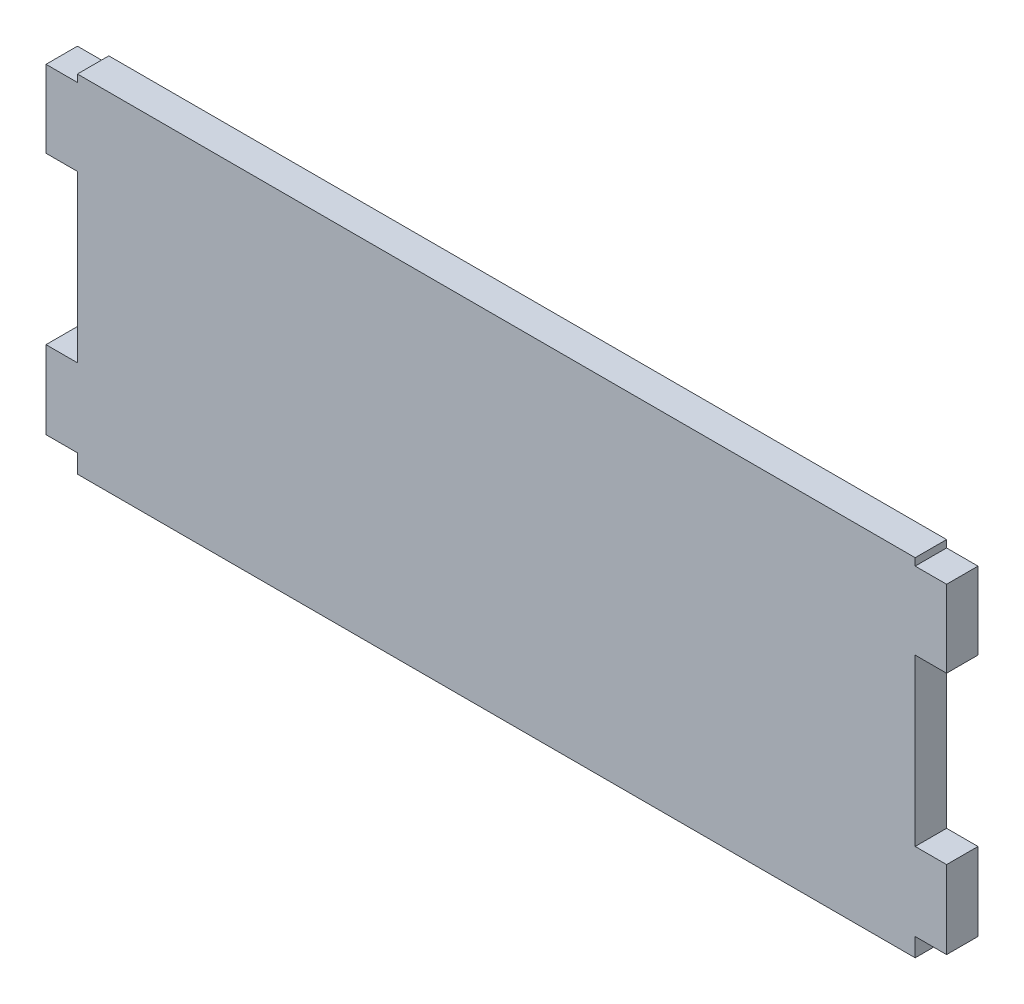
SolidWorks part; units mm, degrees
ref_plane "Plan de face" through (0, 0, 0) normal (0, 0, 1) x (1, 0, 0)
ref_plane "Plan de dessus" through (0, 0, 0) normal (0, 1, 0) x (1, 0, 0)
ref_plane "Plan de droite" through (0, 0, 0) normal (1, 0, 0) x (0, 0, -1)
sketch "Esquisse1" plane through (0, 0, 0) normal (0, 0, 1) x (1, 0, 0)
  line L1 (0, -40.2774) -> (0, 4.4185) construction
  line L2 (0, -4.5914) -> (80, -4.5914)
  line L3 (0, -4.5914) -> (0, -37.6852)
  line L4 (0, -37.6852) -> (80, -37.6852)
  line L5 (80, -4.5914) -> (80, -37.6852)
extrude "Boss.-Extru.1" add sketch "Esquisse1" along normal blind 3
sketch "Esquisse2" plane through (0, 0, 3) normal (0, 0, 1) x (1, 0, 0)
  line L0 (0, -4.5914) -> (0, -37.6852) construction
  line L1 (0, -5.2886) -> (-3, -5.2886)
  line L2 (0, -5.2886) -> (0, -12.648)
  line L3 (0, -12.648) -> (-3, -12.648)
  line L4 (-3, -5.2886) -> (-3, -12.648)
  line L5 (-3, -5.2886) -> (0, -5.2886) construction
  line L6 (-3, -28.4736) -> (0, -28.4736) construction
  line L7 (-3, -20.6165) -> (-3, -67.7761) construction
  line L8 (0, -28.4736) -> (-3, -28.4736)
  line L9 (0, -28.4736) -> (0, -35.92)
  line L10 (0, -35.92) -> (-3, -35.92)
  line L11 (-3, -28.4736) -> (-3, -35.92)
  line L12 (-3, -35.92) -> (0, -35.92) construction
  line L13 (40, -4.5914) -> (40, -37.6852) construction
  line L14 (80, -4.5914) -> (0, -4.5914) construction
  line L15 (0, -37.6852) -> (80, -37.6852) construction
  line L16 (83, -28.4736) -> (83, -35.92)
  line L17 (80, -35.92) -> (83, -35.92)
  line L18 (80, -28.4736) -> (80, -35.92)
  line L19 (80, -28.4736) -> (83, -28.4736)
  line L20 (83, -5.2886) -> (83, -12.648)
  line L21 (80, -12.648) -> (83, -12.648)
  line L22 (80, -5.2886) -> (80, -12.648)
  line L23 (80, -5.2886) -> (83, -5.2886)
extrude "Boss.-Extru.2" add sketch "Esquisse2" against normal blind 3
